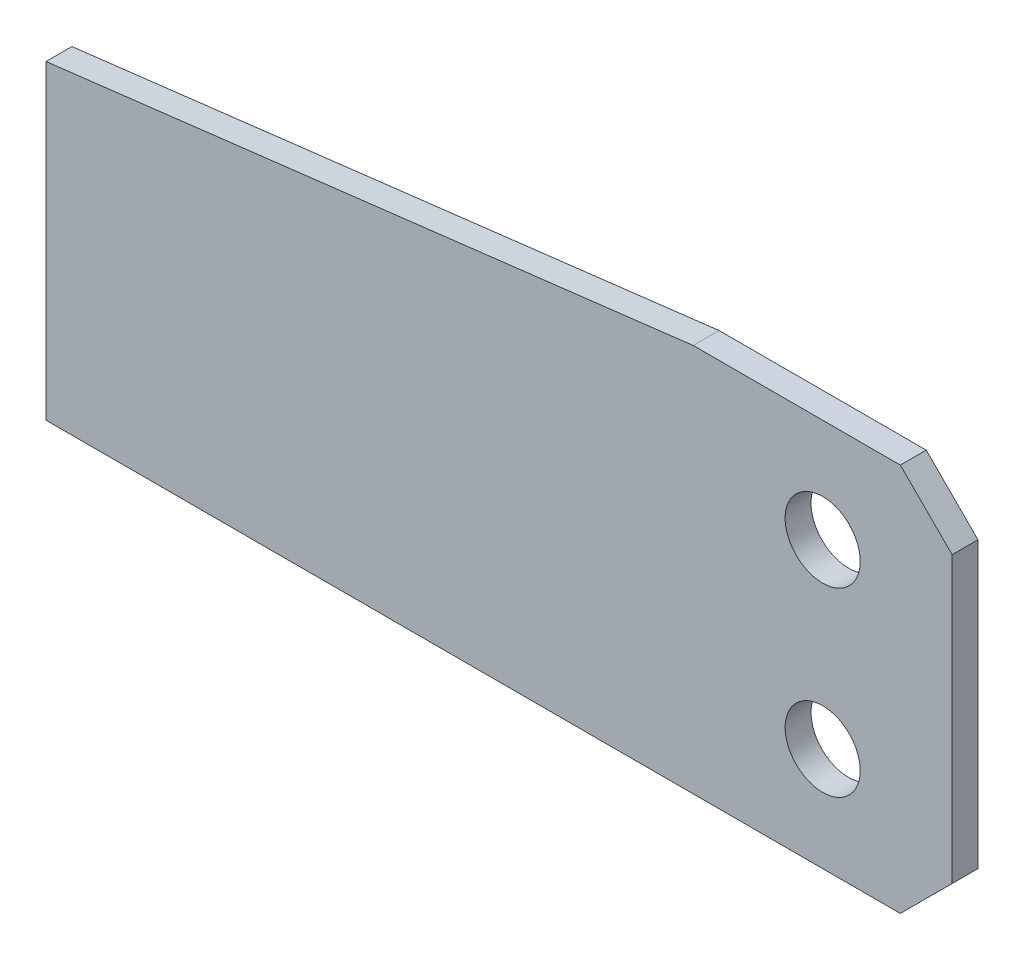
SolidWorks part; units mm, degrees
ref_plane "Face" through (0, 0, 0) normal (0, 0, 1) x (1, 0, 0)
ref_plane "Dessus" through (0, 0, 0) normal (0, 1, 0) x (1, 0, 0)
ref_plane "Droite" through (0, 0, 0) normal (1, 0, 0) x (0, 0, -1)
sketch "Esquisse1" plane through (0, 0, 0) normal (0, 0, 1) x (1, 0, 0)
  line L0 (-100, 0) -> (-350, -30)
  line L1 (-20, 0) -> (-100, 0)
  line L2 (0, -20) -> (0, -130)
  line L3 (-20, -150) -> (-350, -150)
  line L4 (-350, -30) -> (-350, -150)
  line L5 (0, -20) -> (-20, 0)
  line L6 (0, -130) -> (-20, -150)
  circle A0 centre (-50, -40) radius 14.5
  circle A1 centre (-50, -110) radius 14.5
  point P0 (0, 0)
  point P2 (0, -150)
  dimension "D8" = 29
  dimension "D1" = 350
  dimension "D2" = 150
  dimension "D3" = 120
  dimension "D4" = 100
  dimension "D5" = 300
  dimension "D6" = 40
  dimension "D7" = 110
  dimension "D9" = 20
  dimension "D10" = 45
  dimension "D11" = 20
  dimension "D12" = 45
extrude "Base-Extrusion" add sketch "Esquisse1" along normal blind 10
